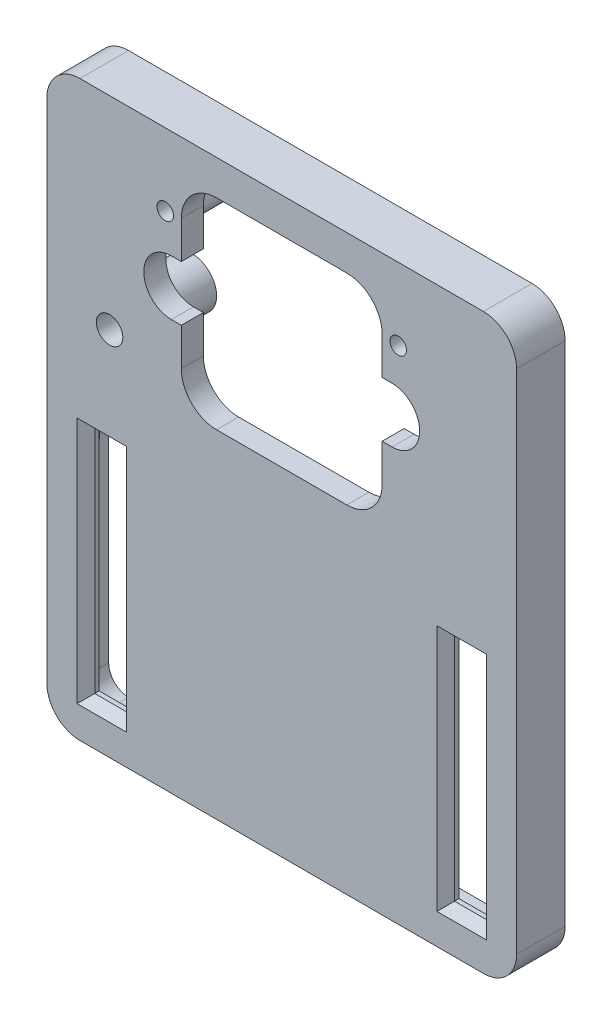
SolidWorks part; units mm, degrees
ref_plane "Alzado" through (0, 0, 0) normal (0, 0, 1) x (1, 0, 0)
ref_plane "Planta" through (0, 0, 0) normal (0, 1, 0) x (1, 0, 0)
ref_plane "Vista lateral" through (0, 0, 0) normal (1, 0, 0) x (0, 0, -1)
sketch "Croquis1" plane through (0, 0, 0) normal (0, 0, 1) x (1, 0, 0)
  line L0 (10, 11.2019) -> (9.1, 11.2019)
  line L5 (-9.1, 13.7019) -> (-9.1, 11.2019) construction
  line L6 (-9.1, 11.2019) -> (-9.1, 7.8019)
  line L7 (-5.9, 22.8019) -> (5.9, 22.8019)
  line L8 (-9.1, 19.6019) -> (-9.1, 16.2019)
  line L9 (-5.9, 4.6019) -> (5.9, 4.6019)
  line L10 (9.1, 19.6019) -> (9.1, 16.2019)
  line L11 (-9.1, 16.2019) -> (-9.1, 13.7019) construction
  line L12 (9.1, 16.2019) -> (10, 16.2019)
  line L13 (9.1, 16.2019) -> (9.1, 11.2019) construction
  line L14 (9.1, 11.2019) -> (9.1, 7.8019)
  line L15 (17.74, -22.41) -> (14.86, -22.41)
  line L16 (5.9, 22.8019) -> (2.2993, 22.8019) construction
  line L17 (-17.74, -1.59) -> (-14.86, -1.59)
  line L18 (-17.74, -1.59) -> (-17.74, -22.41)
  line L19 (-17.74, -22.41) -> (-14.86, -22.41)
  line L20 (-14.86, -1.59) -> (-14.86, -22.41)
  line L21 (14.86, -1.59) -> (14.86, -22.41)
  line L22 (17.74, -1.59) -> (14.86, -1.59)
  line L23 (17.74, -1.59) -> (17.74, -22.41)
  line L25 (0, 25.975) -> (0, 50025.975) construction
  line L26 (0, 0) -> (50000, 0) construction
  line L27 (-21.28, 22.975) -> (-21.28, -22.975)
  line L28 (-18.28, -25.975) -> (18.28, -25.975)
  line L29 (21.28, -22.975) -> (21.28, 22.975)
  line L30 (18.28, 25.975) -> (-18.28, 25.975)
  line L31 (-9.1, 16.2019) -> (-10, 16.2019)
  line L32 (-10, 11.2019) -> (-9.1, 11.2019)
  line L33 (-9.1, 11.2019) -> (-10, 13.7019) construction
  line L34 (-10, 13.7019) -> (-9.1, 13.7019) construction
  arc A0 (-5.9, 4.6019) -> (-9.1, 7.8019) centre (-5.9, 7.8019) cw
  arc A1 (-9.1, 19.6019) -> (-5.9, 22.8019) centre (-5.9, 19.6019) cw
  arc A2 (5.9, 22.8019) -> (9.1, 19.6019) centre (5.9, 19.6019) cw
  arc A3 (9.1, 7.8019) -> (5.9, 4.6019) centre (5.9, 7.8019) cw
  arc A4 (-18.28, 25.975) -> (-21.28, 22.975) centre (-18.28, 22.975) ccw
  arc A5 (18.28, 25.975) -> (21.28, 22.975) centre (18.28, 22.975) cw
  arc A6 (18.28, -25.975) -> (21.28, -22.975) centre (18.28, -22.975) ccw
  arc A7 (-18.28, -25.975) -> (-21.28, -22.975) centre (-18.28, -22.975) cw
  arc A8 (-10, 16.2019) -> (-10, 11.2019) centre (-10, 13.7019) ccw
  arc A9 (10, 16.2019) -> (10, 11.2019) centre (10, 13.7019) cw
  circle A10 centre (-15.5986, 7.5986) radius 1.2
  circle A11 centre (10.557, 19.4351) radius 0.75
  circle A12 centre (-10.557, 19.4351) radius 0.75
  point P0 (0, 0)
  point P3 (0, 22.8019)
  dimension "D5" = 3.2
  dimension "D6" = 3
  dimension "D7" = 0.9
  dimension "D9" = 2.5
  dimension "D17" = 2.4
  dimension "D20" = 1.5
  dimension "D1" = 42.56
  dimension "D2" = 51.95
  dimension "D3" = 3.1731
  dimension "D4" = 18.2
  dimension "D8" = 0.9
  dimension "D10" = 6.6
  dimension "D11" = 180
  dimension "D12" = 18.2
  dimension "D13" = 3.565
  dimension "D14" = 3.54
  dimension "D15" = 2.88
  dimension "D16" = 20.82
  dimension "D18" = 5.6814
  dimension "D19" = 18.3764
  dimension "D21" = 6.5399
  dimension "D22" = 1.457
extrude "Saliente-Extruir1" add sketch "Croquis1" against normal blind 2
chamfer "Chaflán1" distance 0.8 angle 45 16 edges at (16.3, -1.59, -2) (14.86, -12, -2) (17.74, -12, -2) (16.3, -22.41, -2) (14.86, -12, 0) (16.3, -1.59, 0) (17.74, -12, 0) (16.3, -22.41, 0) (-14.86, -12, -2) (-16.3, -1.59, -2) (-17.74, -12, -2) (-16.3, -22.41, -2) (-17.74, -12, 0) (-16.3, -22.41, 0) (-16.3, -1.59, 0) (-14.86, -12, 0)
sketch "Croquis2" plane through (0, 0, -2) normal (0, 0, -1) x (-1, 0, 0)
  line L0 (18.28, 24.775) -> (-18.28, 24.775)
  line L1 (-20.08, 22.975) -> (-20.08, -22.975)
  line L2 (-18.28, -24.775) -> (18.28, -24.775)
  line L3 (20.08, -22.975) -> (20.08, 22.975)
  line L4 (18.28, 25.975) -> (-18.28, 25.975)
  line L5 (-21.28, 22.975) -> (-21.28, -22.975)
  line L6 (-18.28, -25.975) -> (18.28, -25.975)
  line L7 (21.28, -22.975) -> (21.28, 22.975)
  line L8 (18.28, 25.975) -> (-18.28, 25.975)
  line L9 (-21.28, 22.975) -> (-21.28, -22.975)
  line L10 (-18.28, -25.975) -> (18.28, -25.975)
  line L11 (21.28, -22.975) -> (21.28, 22.975)
  arc A0 (20.08, 22.975) -> (18.28, 24.775) centre (18.28, 22.975) ccw
  arc A1 (-18.28, 24.775) -> (-20.08, 22.975) centre (-18.28, 22.975) ccw
  arc A2 (-20.08, -22.975) -> (-18.28, -24.775) centre (-18.28, -22.975) ccw
  arc A3 (18.28, -24.775) -> (20.08, -22.975) centre (18.28, -22.975) ccw
  arc A4 (21.28, 22.975) -> (18.28, 25.975) centre (18.28, 22.975) ccw
  arc A5 (-18.28, 25.975) -> (-21.28, 22.975) centre (-18.28, 22.975) ccw
  arc A6 (-21.28, -22.975) -> (-18.28, -25.975) centre (-18.28, -22.975) ccw
  arc A7 (18.28, -25.975) -> (21.28, -22.975) centre (18.28, -22.975) ccw
  arc A8 (21.28, 22.975) -> (18.28, 25.975) centre (18.28, 22.975) ccw
  arc A9 (-18.28, 25.975) -> (-21.28, 22.975) centre (-18.28, 22.975) ccw
  arc A10 (-21.28, -22.975) -> (-18.28, -25.975) centre (-18.28, -22.975) ccw
  arc A11 (18.28, -25.975) -> (21.28, -22.975) centre (18.28, -22.975) ccw
  dimension "D1" = 0
  dimension "D2" = 1.2
extrude "Saliente-Extruir2" add sketch "Croquis2" along normal blind 2.4
sketch "Croquis3" plane through (0, 0, -2) normal (0, 0, -1) x (-1, 0, 0)
  circle A0 centre (15.5986, 7.5986) radius 2.2
  circle A1 centre (10.557, 19.4351) radius 1.3499
  circle A2 centre (-10.557, 19.4351) radius 1.3499
  circle A3 centre (15.5986, 7.5986) radius 1.2 construction
  circle A4 centre (-10.557, 19.4351) radius 0.75 construction
  circle A5 centre (10.557, 19.4351) radius 0.75 construction
  circle A6 centre (15.5986, 7.5986) radius 1.2
  circle A7 centre (-10.557, 19.4351) radius 0.75
  circle A8 centre (10.557, 19.4351) radius 0.75
  dimension "D1" = 4.4
  dimension "D2" = 2.6998
extrude "Saliente-Extruir3" add sketch "Croquis3" along normal blind 6.5 contours A2 M21 | A1 M20 | A8 | A7
sketch "Croquis4" plane through (0, 0, -8.5) normal (0, 0, -1) x (-1, 0, 0)
  line L0 (-11.8109, 19.4351) -> (-10.557, 19.4351) construction
  line L1 (-11.8109, 19.9351) -> (-17.2747, 19.9351)
  line L2 (-11.8109, 19.4351) -> (-11.8109, 18.9351) construction
  line L3 (-11.8109, 18.9351) -> (-17.2747, 18.9351)
  line L4 (-17.2747, 19.9351) -> (-17.2747, 18.9351)
  line L5 (-11.8109, 19.9351) -> (-11.8109, 19.4351) construction
  line L6 (0, 22.8019) -> (0, -49977.1981) construction
  line L7 (-5.9, 22.8019) -> (5.9, 22.8019) construction
  line L8 (11.8109, 19.9351) -> (17.2747, 19.9351)
  line L9 (17.2747, 19.9351) -> (17.2747, 18.9351)
  line L10 (11.8109, 18.9351) -> (17.2747, 18.9351)
  circle A0 centre (-10.557, 19.4351) radius 1.3499 construction
  circle A1 centre (-10.557, 19.4351) radius 1.3499 construction
  arc A2 (-11.8109, 19.9351) -> (-11.8109, 18.9351) centre (-10.557, 19.4351) ccw
  arc A3 (-11.8109, 18.9351) -> (-11.8109, 19.9351) centre (-10.557, 19.4351) ccw construction
  arc A4 (11.8109, 19.9351) -> (11.8109, 18.9351) centre (10.557, 19.4351) cw
  point P13 (0, 22.8019)
  dimension "D1" = 5.4638
  dimension "D2" = 1
extrude "Saliente-Extruir4" add sketch "Croquis4" against normal up to surface (6.5 mm away)
sketch "Croquis5" plane through (0, 18.9351, 0) normal (0, -1, 0) x (1, 0, 0)
  line L0 (12.2747, -8.5) -> (17.2747, -3.5)
  line L1 (17.2747, -3.5) -> (17.2747, -8.5)
  line L2 (17.2747, -8.5) -> (12.2747, -8.5)
  line L3 (0, 0) -> (0, 50000) construction
  line L4 (17.2747, -8.5) -> (17.2747, -2)
  line L5 (17.2747, -2) -> (11.8109, -2)
  line L6 (11.8109, -2) -> (11.8109, -8.5)
  line L7 (11.8109, -8.5) -> (17.2747, -8.5)
  line L8 (17.2747, -8.5) -> (17.2747, -2) construction
  line L9 (17.2747, -2) -> (11.8109, -2) construction
  line L10 (11.8109, -2) -> (11.8109, -8.5) construction
  line L11 (11.8109, -8.5) -> (17.2747, -8.5) construction
  line L12 (-18.28, 0) -> (18.28, 0) construction
  line L13 (-17.2747, -3.5) -> (-17.2747, -8.5)
  line L14 (-12.2747, -8.5) -> (-17.2747, -3.5)
  line L15 (-17.2747, -8.5) -> (-12.2747, -8.5)
  point P10 (0, 0)
  dimension "D2" = 1.5
  dimension "D3" = 0.4638
  dimension "D1" = 0
extrude "Cortar-Extruir1" cut sketch "Croquis5" against normal up to next
sketch "Croquis6" plane through (0, 0, -2) normal (0, 0, -1) x (-1, 0, 0)
  circle A0 centre (15.5986, 7.5986) radius 1.2 construction
  circle A1 centre (15.5986, 7.5986) radius 1.2
  circle A2 centre (15.5986, 7.5986) radius 2.2
  dimension "D1" = 4.4
extrude "Saliente-Extruir5" add sketch "Croquis6" along normal blind 5.5
chamfer "Chaflán2" distance 1 angle 45 1 edges at (-13.3986, 7.5986, -2)
sketch "Croquis7" plane through (0, 0, 0) normal (1, 0, 0) x (0, 0, -1)
  line L0 (4.4, 24.775) -> (2, 24.775) construction
  line L1 (4.4, 24.775) -> (2, 24.775) construction
  line L2 (2.4286, 24.775) -> (3.5714, 24.775)
  line L3 (2.4286, 24.775) -> (3, 25.175)
  line L4 (3, 25.175) -> (3.5714, 24.775)
  line L5 (0, 0) -> (50000, 0) construction
  line L6 (0, -22.975) -> (0, 22.975) construction
  line L7 (2.4286, -24.775) -> (3.5714, -24.775)
  line L8 (3, -25.175) -> (3.5714, -24.775)
  line L9 (2.4286, -24.775) -> (3, -25.175)
  point P9 (0, 0)
  dimension "D1" = 1.1429
  dimension "D2" = 0.4286
  dimension "D3" = 0.4
extrude "Cortar-Extruir2" cut sketch "Croquis7" against normal mid plane 10
sketch "Croquis8" plane through (0, 0, 0) normal (0, 1, 0) x (1, 0, 0)
  line L0 (20.08, 2) -> (18.28, 2) construction
  line L1 (20.08, 2) -> (18.28, 2) construction
  line L2 (20.08, 4.4) -> (20.08, 2) construction
  line L3 (20.08, 4.4) -> (20.08, 2) construction
  line L4 (20.08, 2.4286) -> (20.08, 3.5686)
  line L5 (20.08, 3.5686) -> (20.48, 2.9986)
  line L6 (20.48, 2.9986) -> (20.08, 2.4286)
  line L7 (0, 0) -> (0, 50000) construction
  line L8 (18.28, 0) -> (-18.28, 0) construction
  line L9 (-20.48, 2.9986) -> (-20.08, 2.4286)
  line L10 (-20.08, 2.4286) -> (-20.08, 3.5686)
  line L11 (-20.08, 3.5686) -> (-20.48, 2.9986)
  point P10 (0, 0)
  dimension "D1" = 0.4286
  dimension "D2" = 0.4
  dimension "D3" = 1.14
extrude "Cortar-Extruir3" cut sketch "Croquis8" against normal mid plane 10
